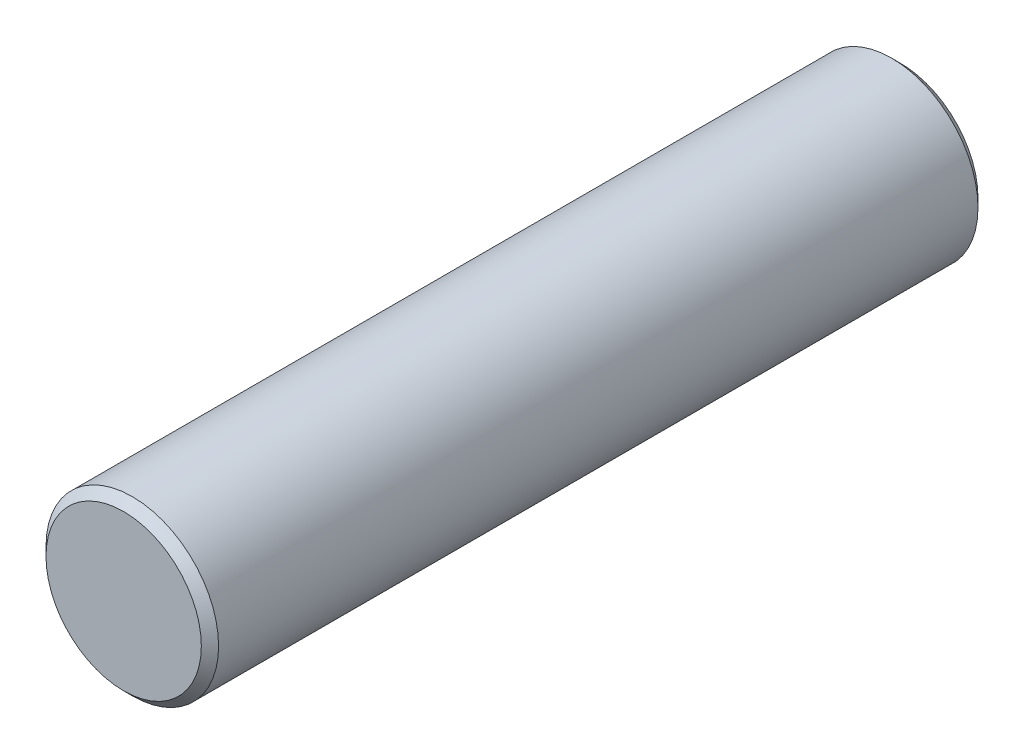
SolidWorks part; units mm, degrees
ref_plane "Plan de face" through (0, 0, 0) normal (0, 0, 1) x (1, 0, 0)
ref_plane "Plan de dessus" through (0, 0, 0) normal (0, 1, 0) x (1, 0, 0)
ref_plane "Plan de droite" through (0, 0, 0) normal (1, 0, 0) x (0, 0, -1)
sketch "Esquisse1" plane through (0, 0, 0) normal (0, 0, 1) x (1, 0, 0)
  circle A0 centre (0, 0) radius 5
  dimension "D1" = 10
extrude "Extrusion1" add sketch "Esquisse1" along normal blind 45
chamfer "Chanfrein1" distance 0.5 angle 45 2 edges at (5, 0, 0) (5, 0, 45)
